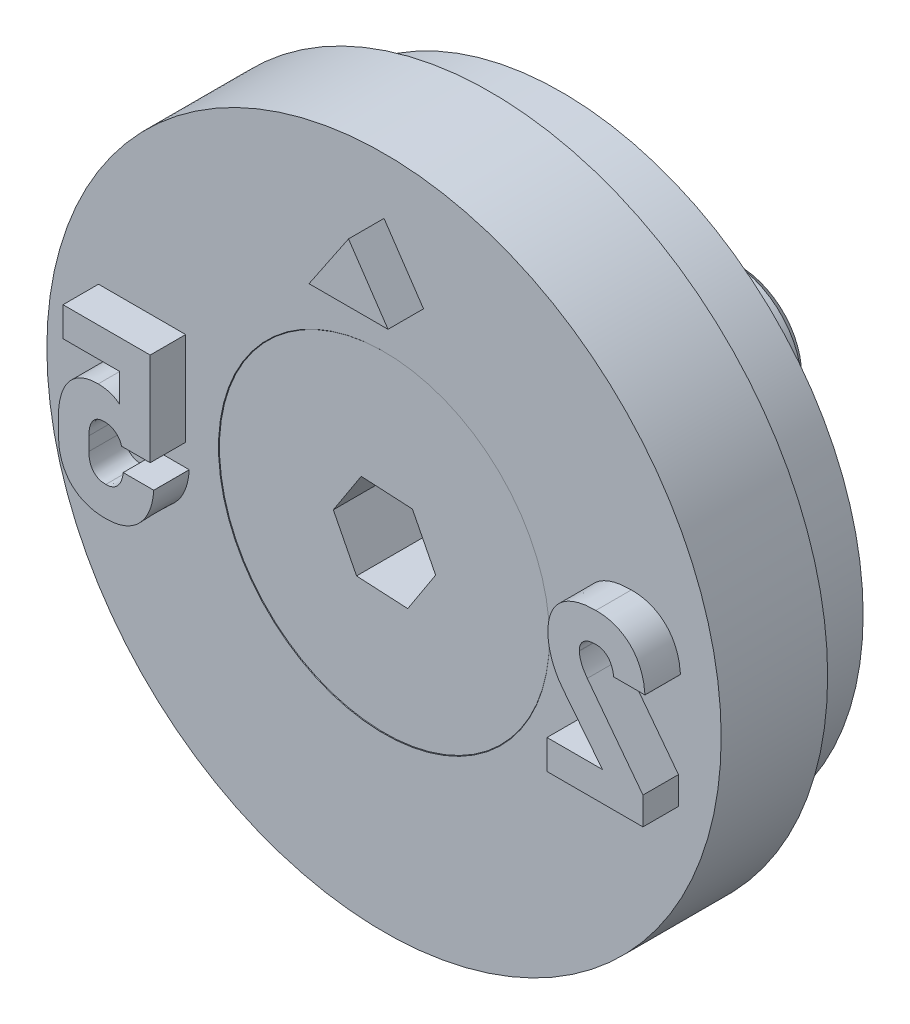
SolidWorks part; units mm, degrees
other "<M4 X .7 FHCS>-<Imported1>"
ref_plane "Front Plane" through (0, 0, 0) normal (0, 0, 1) x (1, 0, 0)
ref_plane "Top Plane" through (0, 0, 0) normal (0, 1, 0) x (1, 0, 0)
ref_plane "Right Plane" through (0, 0, 0) normal (1, 0, 0) x (0, 0, -1)
imported_body "Imported1"
other "DeleteFace1"
sketch "Sketch1" plane through (0, 0, 0) normal (0, 0, 1) x (1, 0, 0)
  line L0 (0, 7.9145) -> (-1.1129, 6.2645)
  line L1 (-1.1129, 6.2645) -> (1.1129, 6.2645)
  line L2 (1.1129, 6.2645) -> (0, 7.9145)
  text T0 "2      5" font "Bahnschrift" height 4.572
  dimension "D1" = 2.286
extrude "Boss-Extrude1" add sketch "Sketch1" along normal blind 1
inserted part "M4 X .7 FHCS"
move or copy body "Body-Move/Copy2" placed by mates yes
